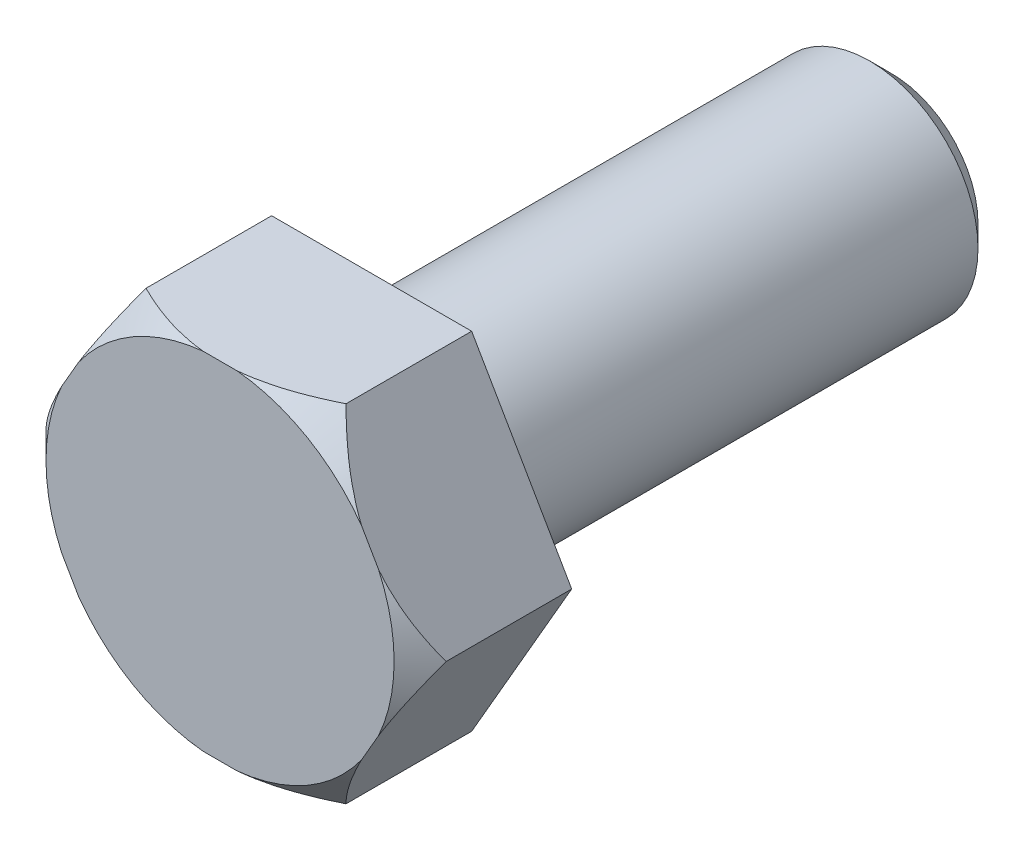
SolidWorks part; units mm, degrees
ref_plane "Plan de face" through (0, 0, 0) normal (0, 0, 1) x (1, 0, 0)
ref_plane "Plan de dessus" through (0, 0, 0) normal (0, 1, 0) x (1, 0, 0)
ref_plane "Plan de droite" through (0, 0, 0) normal (1, 0, 0) x (0, 0, -1)
sketch "Esquisse1" plane through (0, 0, 0) normal (0, 0, 1) x (1, 0, 0)
  line L1 (4.6188, 0) -> (2.3094, 4)
  line L2 (2.3094, 4) -> (-2.3094, 4)
  line L3 (-2.3094, 4) -> (-4.6188, 0)
  line L4 (-4.6188, 0) -> (-2.3094, -4)
  line L5 (-2.3094, -4) -> (2.3094, -4)
  line L6 (2.3094, -4) -> (4.6188, 0)
  circle A0 centre (0, 0) radius 4 construction
  dimension "D1" = 8
extrude "Boss.-Extru.1" add sketch "Esquisse1" along normal blind 3.5
sketch "Esquisse3" plane through (0, 0, 0) normal (0, 1, 0) x (1, 0, 0)
  line L0 (0, 2.9031) -> (0, -10.4428) construction
  line L1 (-4.6188, -2.9) -> (-4.0188, -3.5)
  line L2 (-9.0249, -6.5429) -> (-4.0188, -6.5429)
  line L3 (-9.0249, -6.5429) -> (-9.0249, -2.9)
  line L4 (-9.0249, -2.9) -> (-4.6188, -2.9)
  line L5 (-4.0188, -6.5429) -> (-4.0188, -3.5)
  line L6 (-4.6188, -3.5) -> (-4.6188, 0) construction
  line L8 (-2.3094, -3.5) -> (-4.6188, -3.5) construction
  dimension "D1" = 0.6
  dimension "D2" = 0.6
revolve "Enlèvement de matière-Révolution2" cut sketch "Esquisse3" angle 360 about L0
sketch "Esquisse4" plane through (0, 0, 0) normal (1, 0, 0) x (0, 0, -1)
  line L0 (0, 0) -> (83.8832, 0) construction
  line L1 (0, -2.5) -> (11.5, -2.5)
  line L2 (0, -4) -> (0, 0) construction
  line L3 (12, -2) -> (12, 0)
  line L4 (11.5, -2.5) -> (12, -2)
  line L5 (0, -2.5) -> (0, 0)
  line L6 (0, 0) -> (12, 0)
  point P4 (12, -2.5)
  dimension "D1" = 2.5
  dimension "D2" = 12
  dimension "D6" = 0.5
revolve "Révolution2" add sketch "Esquisse4" angle 360 about L0
